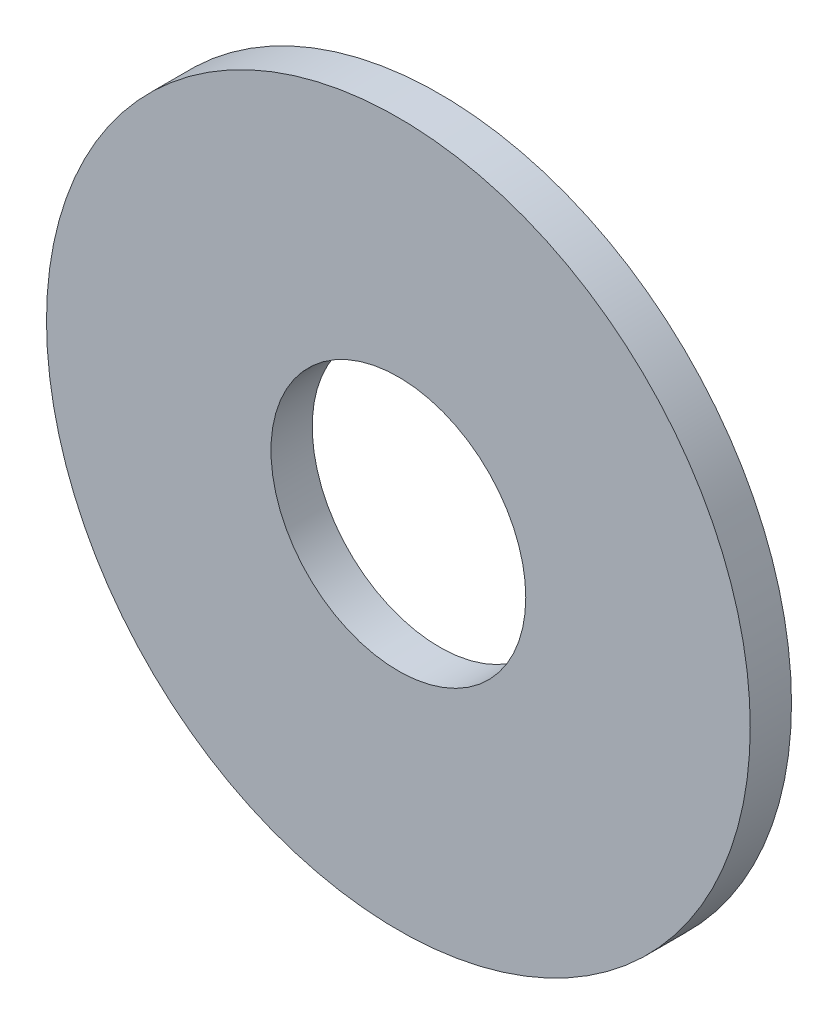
SolidWorks part; units mm, degrees
ref_plane "Plan de face" through (0, 0, 0) normal (0, 0, 1) x (1, 0, 0)
ref_plane "Plan de dessus" through (0, 0, 0) normal (0, 1, 0) x (1, 0, 0)
ref_plane "Plan de droite" through (0, 0, 0) normal (1, 0, 0) x (0, 0, -1)
sketch "Esquisse1" plane through (0, 0, 0) normal (0, 0, 1) x (1, 0, 0)
  circle A0 centre (0, 0) radius 14.5
  circle A1 centre (0, 0) radius 5.25
  dimension "D1" = 10.5
  dimension "D2" = 29
extrude "Extrusion1" add sketch "Esquisse1" along normal blind 1.7
